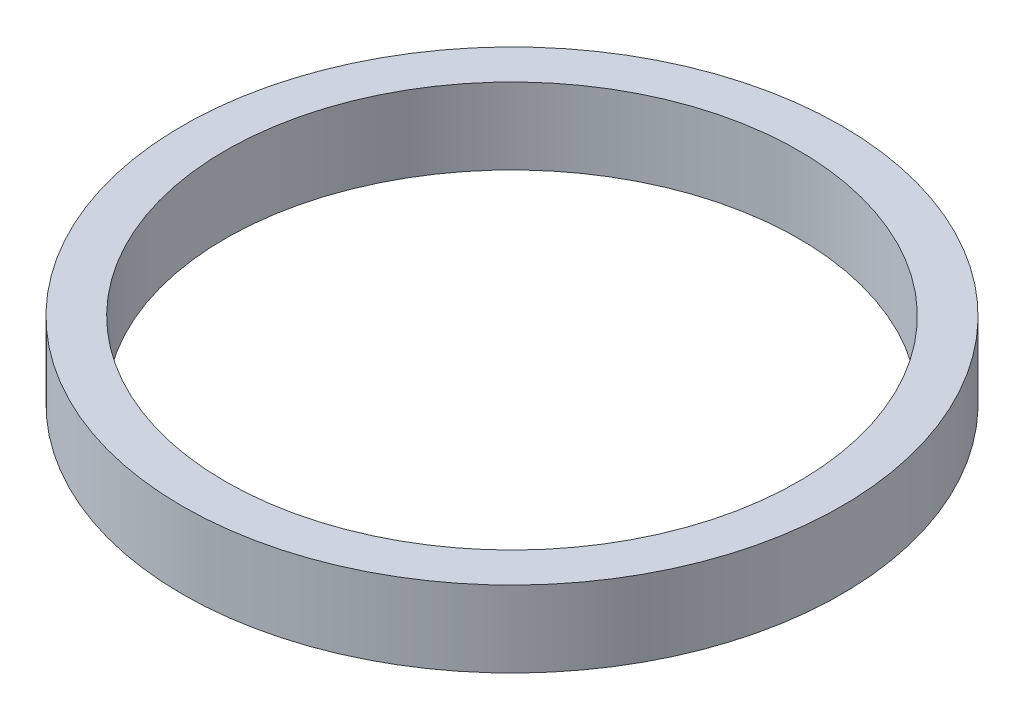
SolidWorks part; units mm, degrees
ref_plane "Front Plane" through (0, 0, 0) normal (0, 0, 1) x (1, 0, 0)
ref_plane "Top Plane" through (0, 0, 0) normal (0, 1, 0) x (1, 0, 0)
ref_plane "Right Plane" through (0, 0, 0) normal (1, 0, 0) x (0, 0, -1)
sketch "Sketch1" plane through (0, 0, 0) normal (0, 1, 0) x (1, 0, 0)
  circle A3 centre (-234.7562, 468.3278) radius 112.884
  circle A4 centre (-234.7562, 468.3278) radius 129.7842
extrude "Boss-Extrude1" add sketch "Sketch1" along normal blind 30
